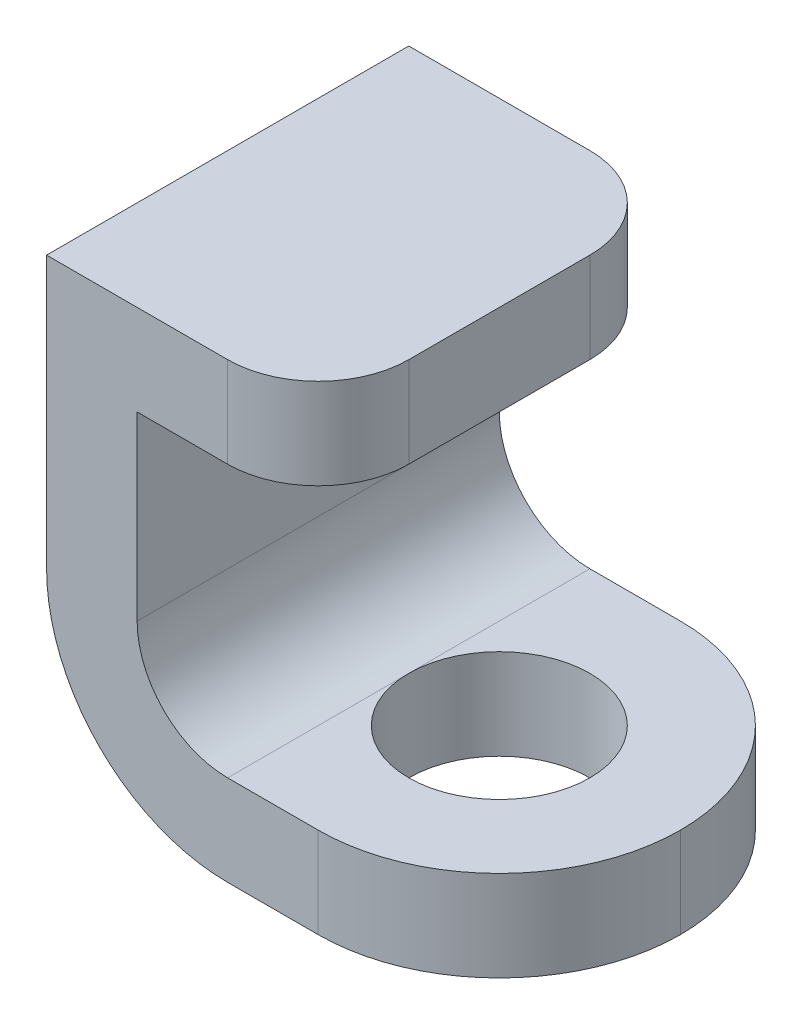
SolidWorks part; units mm, degrees
ref_plane "Front Plane" through (0, 0, 0) normal (0, 0, 1) x (1, 0, 0)
ref_plane "Top Plane" through (0, 0, 0) normal (0, 1, 0) x (1, 0, 0)
ref_plane "Right Plane" through (0, 0, 0) normal (1, 0, 0) x (0, 0, -1)
sketch "Sketch1" plane through (0, 0, 0) normal (0, 0, 1) x (1, 0, 0)
  line L0 (0, 0) -> (-30, 0)
  line L1 (-50, 20) -> (-50, 50)
  line L2 (-50, 50) -> (-20, 50)
  arc A0 (-30, 0) -> (-50, 20) centre (-30, 20) cw
  dimension "D2" = 20
  dimension "D1" = 50
  dimension "D3" = 50
  dimension "D4" = 30
extrude "Extrude-Thin1" add sketch "Sketch1" along normal mid plane 40 thin
fillet "Fillet1" radius 10 2 edges at (-20, 45, -20) (-20, 45, 20)
fillet "Fillet2" radius 20 2 edges at (0, 5, -20) (0, 5, 20)
sketch "Sketch3" plane through (0, 0, 0) normal (0, -1, 0) x (1, 0, 0)
  circle A0 centre (-20, 0) radius 10
  dimension "D1" = 20
extrude "Extrude1" cut sketch "Sketch3" against normal blind 10
